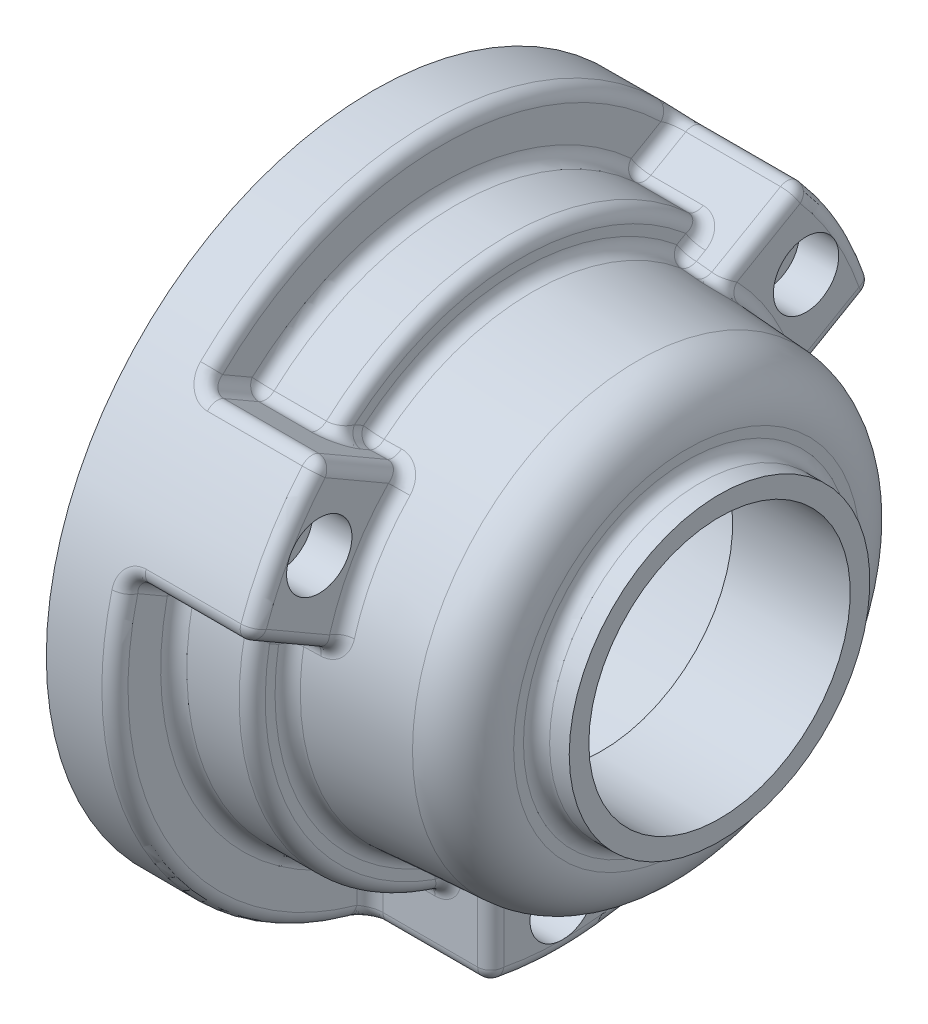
SolidWorks part; units mm, degrees
ref_plane "Plan1" through (0, 0, 0) normal (0, 0, 1) x (1, 0, 0)
ref_plane "Plan2" through (0, 0, 0) normal (0, 1, 0) x (1, 0, 0)
ref_plane "Plan3" through (0, 0, 0) normal (1, 0, 0) x (0, 0, -1)
sketch "Esquisse1" plane through (0, 0, 0) normal (0, 0, 1) x (1, 0, 0)
  line L0 (-110, 0) -> (100, 0) construction
  line L1 (-70, -37) -> (-70, -50)
  line L2 (-70, -50) -> (-59.5, -50)
  line L3 (-29.81, -30.2831) -> (-55, -32.8538)
  line L4 (-47.5, -39) -> (-47.5, -37.504)
  line L5 (-70, -37) -> (-55, -37)
  line L6 (-35, -20) -> (-17, -20)
  line L7 (-17, -20) -> (-17, -23)
  line L8 (-34, -23) -> (-30, -23)
  line L9 (-35, -20) -> (-35, -22)
  line L10 (-22, -25) -> (-22, -26.5002)
  line L11 (-55, -37) -> (-55, -32.8538)
  line L13 (-45.6267, -35.508) -> (-29.4933, -34.4842)
  line L14 (-27, -26) -> (-27, -27.2892)
  line L15 (-20, -23) -> (-17, -23)
  line L16 (-59.5, -50) -> (-59.5, -41)
  line L17 (-59.5, -41) -> (-49.5, -41)
  arc A0 (-27, -26) -> (-30, -23) centre (-30, -26) ccw
  arc A1 (-27, -27.2892) -> (-29.81, -30.2831) centre (-30, -27.2892) cw
  arc A2 (-22, -26.5002) -> (-29.4933, -34.4842) centre (-30, -26.5002) cw
  arc A3 (-35, -22) -> (-34, -23) centre (-34, -22) ccw
  arc A4 (-22, -25) -> (-20, -23) centre (-20, -25) cw
  arc A5 (-47.5, -37.504) -> (-45.6267, -35.508) centre (-45.5, -37.504) cw
  arc A6 (-47.5, -39) -> (-49.5, -41) centre (-49.5, -39) cw
  point P11 (-46.5, -50)
  point P28 (-22, -23)
  point P29 (-35, -20)
  point P32 (-55.5, -35.5)
  dimension "D5" = 20
  dimension "D6" = 53
  dimension "D7" = 18
  dimension "D8" = 23
  dimension "D12" = 3
  dimension "D13" = 8
  dimension "D14" = 1
  dimension "D17" = 2
  dimension "D18" = 2
  dimension "D9" = 2
  dimension "D1" = 50
  dimension "D2" = 23.5
  dimension "D3" = 37
  dimension "D4" = 15
  dimension "D10" = 5
  dimension "D11" = 5
  dimension "D15" = 10.5
  dimension "D16" = 41
revolve "Base-Révolution" add sketch "Esquisse1" angle 360 about L0
sketch "Esquisse3" plane through (-59.5, 0, 0) normal (1, 0, 0) x (0, 0, -1)
  line L0 (0, 50) -> (0, -60) construction
  line L1 (-60, 0) -> (60, 0) construction
  line L2 (0, 0) -> (-55.4527, 32.0156) construction
  line L3 (0, 0) -> (50.4975, 29.1548) construction
  line L4 (-11, -35.327) -> (-11, -48.775)
  line L5 (11, -35.327) -> (11, -48.775)
  arc A0 (-11, -48.775) -> (11, -48.775) centre (0, 0) ccw
  arc A1 (-11, -35.327) -> (11, -35.327) centre (0, 0) ccw
  dimension "D5" = 100
  dimension "D6" = 74
  dimension "D1" = 120
  dimension "D2" = 120
  dimension "D3" = 11
  dimension "D4" = 11
extrude "Boss.-Extru.1" add sketch "Esquisse3" along normal blind 18.5
sketch "Esquisse10" plane through (-41, 0, 0) normal (1, 0, 0) x (0, 0, -1)
  line L0 (-11, -35.327) -> (-11, -31.9534)
  line L1 (11, -35.327) -> (11, -31.9534)
  arc A0 (-11, -35.327) -> (11, -35.327) centre (0, 0) ccw construction
  arc A1 (-11, -35.327) -> (11, -35.327) centre (0, 0) ccw
  arc A2 (-11, -31.9534) -> (11, -31.9534) centre (0, 0) ccw
extrude "Extrusion1" add sketch "Esquisse10" against normal up to surface (6.5 mm away)
fillet "Congé1" radius 2 3 edges at (-50.25, -48.775, 11) (-50.25, -48.775, -11) (-41, -50, 0)
fillet "Congé2" radius 2 19 edges at (-41.5584, -48.215, -10.6921) (-46.6623, -34.1485, -11) (-47.5, -36.6356, -11) (-50.6637, -35.718, -11) (-59.5, -48.4235, -10.5411) (-41.5584, -48.215, 10.6921) (-46.9582, -34.4203, 11) (-47.5, -36.6356, 11) (-50.8294, -35.8565, 11) (-59.5, -48.4235, 10.5411) (-41, -40.0874, -11) (-54.5, -39.4968, -11) (-59.5, -43.3228, -11) (-41, -40.0874, 11) (-41, -35.2144, 0) (-54.5, -39.4968, 11) (-59.5, -43.3228, 11)
pattern_circular "Répétition circulaire1" count 3 every 120 of "Congé1", "Boss.-Extru.1", "Extrusion1", "Congé2"
sketch "Esquisse8" plane through (-41, 0, 0) normal (1, 0, 0) x (0, 0, -1)
  circle A3 centre (-37.2391, 21.5) radius 3
  dimension "D3" = 6
  dimension "D5" = 43
sketch "Esquisse9" plane through (-41, 0, 0) normal (1, 0, 0) x (0, 0, -1)
  circle A0 centre (-37.2391, 21.5) radius 5
  dimension "D1" = 10
extrude "Enlèv. mat.-Extru.5" cut sketch "Esquisse9" against normal blind 6
extrude "Enlèv. mat.-Extru.6" cut sketch "Esquisse8" against normal through all
pattern_circular "Répétition circulaire3" count 3 every 120 about axis through (0, 0, 0) along (1, 0, 0) of "Enlèv. mat.-Extru.5", "Enlèv. mat.-Extru.6"
fillet "Congé3" radius 2 24 edges at (-59.3285, 34.5524, 36.1404) (-58.9142, 33.6079, 35.0391) (-59.3285, 34.5524, -36.1404) (-58.9142, 33.6079, -35.0391) (-58.6812, 29.7639, 28.7804) (-58.6812, 29.7639, -28.7804) (-59.3285, 14.0223, -47.9935) (-58.9142, 13.5408, -46.6249) (-59.3285, -48.5747, -11.8531) (-58.9142, -47.1487, -11.5858) (-58.6812, 10.0426, -40.1665) (-58.6812, -39.8066, -11.3861) (-59.3285, -48.5747, 11.8531) (-58.9142, -47.1487, 11.5858) (-59.3285, 14.0223, 47.9935) (-58.9142, 13.5408, 46.6249) (-58.6812, -39.8066, 11.3861) (-58.6812, 10.0426, 40.1665) (-59.5, 50, 0) (-59.5, 41, 0) (-59.5, -25, -43.3013) (-59.5, -20.5, -35.507) (-59.5, -25, 43.3013) (-59.5, -20.5, 35.507)
